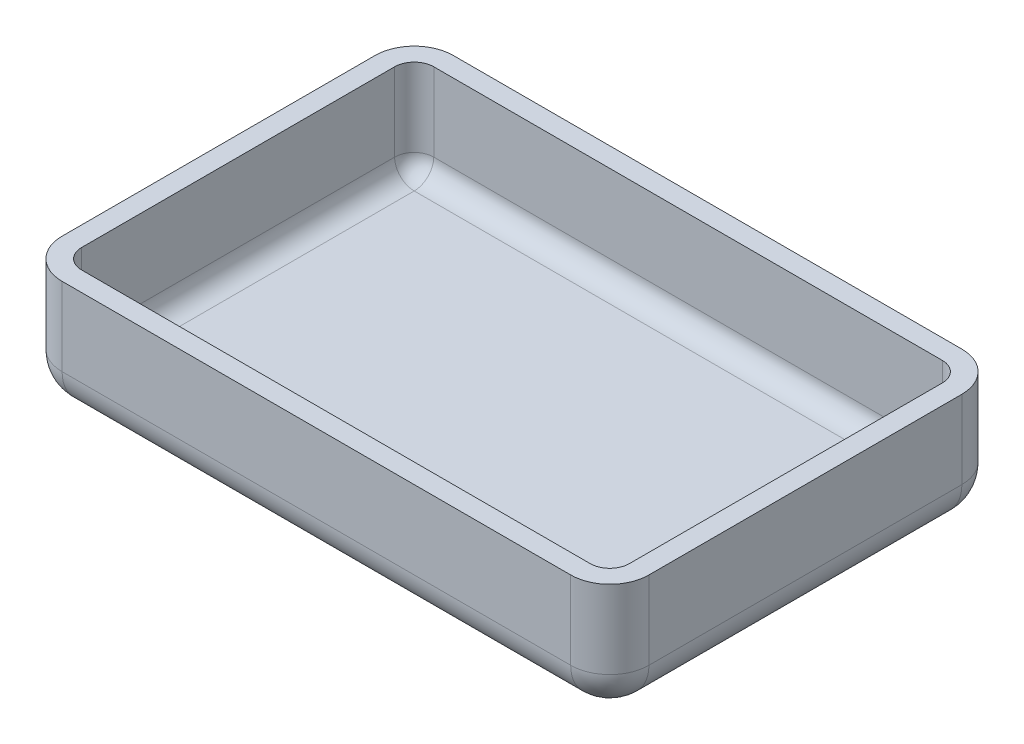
SolidWorks part; units mm, degrees
ref_plane "Front" through (0, 0, 0) normal (0, 0, 1) x (1, 0, 0)
ref_plane "Top" through (0, 0, 0) normal (0, 1, 0) x (1, 0, 0)
ref_plane "Right" through (0, 0, 0) normal (1, 0, 0) x (0, 0, -1)
sketch "Sketch2" plane through (0, 0, 0) normal (0, 1, 0) x (1, 0, 0)
  line L0 (75, -50) -> (-75, 50) construction
  line L1 (-75, 50) -> (75, 50)
  line L2 (-75, 50) -> (-75, -50)
  line L3 (-75, -50) -> (75, -50)
  line L4 (75, 50) -> (75, -50)
  dimension "D1" = 150
  dimension "D2" = 100
extrude "Extrude1" add sketch "Sketch2" along normal blind 30
fillet "Fillet1" radius 10 8 edges at (0, 0, 50) (75, 0, 0) (0, 0, -50) (-75, 0, 0) (-75, 15, -50) (-75, 15, 50) (75, 15, -50) (75, 15, 50)
shell "Shell1" thickness 5
